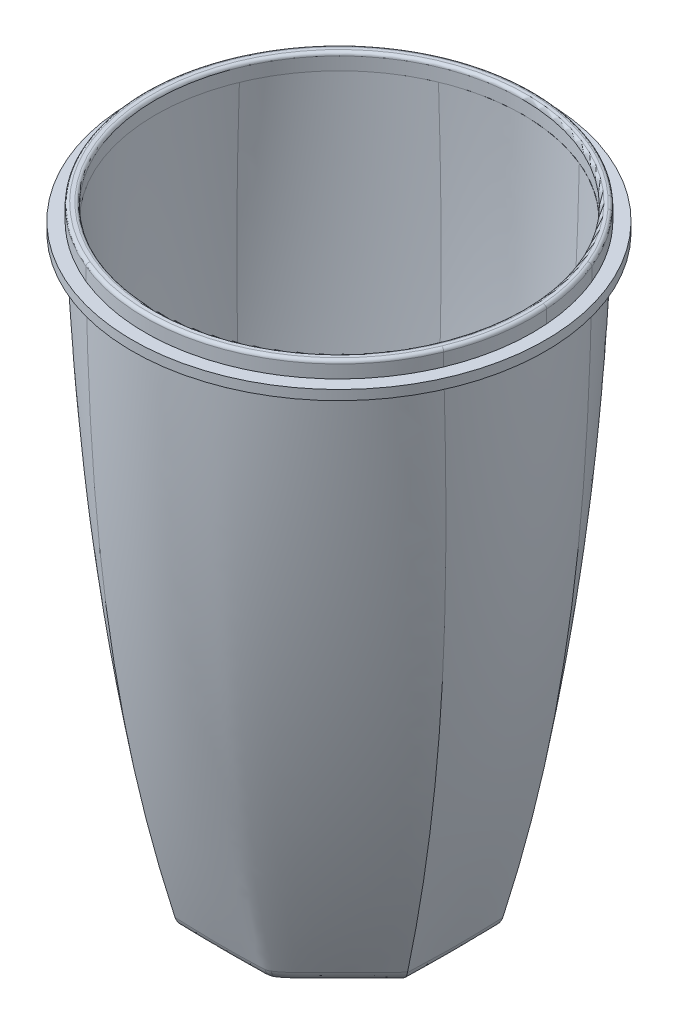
SolidWorks part; units mm, degrees
ref_plane "Front Plane" through (0, 0, 0) normal (0, 0, 1) x (1, 0, 0)
ref_plane "Top Plane" through (0, 0, 0) normal (0, 1, 0) x (1, 0, 0)
ref_plane "Right Plane" through (0, 0, 0) normal (1, 0, 0) x (0, 0, -1)
sketch "Sketch1" plane through (0, 0, 0) normal (0, 0, 1) x (1, 0, 0)
  line L0 (0, 0) -> (0, 180) construction
  line L1 (-60, 180) -> (60, 180) construction
  line L2 (60, 252.6876) -> (60, 107.3124) construction
  line L3 (35, 0) -> (-35, 0) construction
  spline S0 degree 3 poles (35, 0) (56.3532, 64.0298) (60, 119.427) (60, 180) knots 0 0 0 0 1 1 1 1
  spline S1 degree 3 poles (-35, 0) (-56.3532, 64.0298) (-60, 119.427) (-60, 180) knots 0 0 0 0 1 1 1 1
  dimension "D1" = 180
  dimension "D2" = 60
  dimension "D3" = 35
sketch "Sketch6" plane through (0, 0, 0) normal (0, 1, 0) x (1, 0, 0)
  line L0 (0, 0) -> (35, 0) construction
  line L1 (35, -14.4975) -> (35, 14.4975)
  line L2 (35, 14.4975) -> (14.4975, 35)
  line L3 (14.4975, 35) -> (-14.4975, 35)
  line L4 (-14.4975, 35) -> (-35, 14.4975)
  line L5 (-35, 14.4975) -> (-35, -14.4975)
  line L6 (-35, -14.4975) -> (-14.4975, -35)
  line L7 (-14.4975, -35) -> (14.4975, -35)
  line L8 (14.4975, -35) -> (35, -14.4975)
  line L9 (35, 0) -> (-35, 0) construction
  circle A0 centre (0, 0) radius 35 construction
ref_plane "Plane3" through (0, 180, 0) normal (0, 1, 0) x (1, 0, 0)
sketch "Sketch7" plane through (0, 180, 0) normal (0, 1, 0) x (1, 0, 0)
  circle A0 centre (0, 0) radius 60
sketch "Sketch8" plane through (0, 0, 0) normal (1, 0, 0) x (0, 0, -1)
  line L0 (0, 0) -> (0, 180) construction
  line L1 (-60, 180) -> (60, 180) construction
  line L2 (60, 252.6876) -> (60, 107.3124) construction
  line L3 (35, 0) -> (-35, 0) construction
  spline S0 degree 3 poles (35, 0) (56.3532, 64.0298) (60, 119.427) (60, 180) knots 0 0 0 0 1 1 1 1
  spline S1 degree 3 poles (-35, 0) (-56.3532, 64.0298) (-60, 119.427) (-60, 180) knots 0 0 0 0 1 1 1 1
  dimension "D1" = 180
  dimension "D2" = 60
  dimension "D3" = 35
loft "Loft1" add profiles "Sketch6", "Sketch7"
shell "Shell2" thickness 3
fillet "Fillet1" radius 5 6 edges at (32.8311, 3, 1.7594) (12.7425, 3, 32.6342) (-32.6342, 3, 12.7425) (-23.1273, 3, -23.1277) (1.7594, 3, -32.8311) (23.1277, 3, -23.1273)
fillet "Fillet2" radius 5 6 edges at (0, 0, -35) (-24.7487, 0, -24.7487) (35, 0, 0) (24.7487, 0, -24.7487)
sketch "Sketch9" plane through (0, 180, 0) normal (0, 1, 0) x (1, 0, 0)
  circle A0 centre (0, 0) radius 60
  circle A1 centre (0, 0) radius 64
  dimension "D1" = 4
extrude "Boss-Extrude1" add sketch "Sketch9" against normal blind 3 separate body
sketch "Sketch10" plane through (0, 180, 0) normal (0, 1, 0) x (1, 0, 0)
  circle A0 centre (0.0741, 0.0741) radius 56.9599
  arc A1 (44.2404, 40.5313) -> (40.5313, 44.2404) centre (0.0741, 0.0741) ccw
  arc A2 (44.2404, 40.5313) -> (40.5313, 44.2404) centre (0.0741, 0.0741) ccw
  spline S8 degree 2 poles (-3966.3836, -2910.012) (258.9396, -294.8696) (50.6051, 32.2357) (-157.23, 358.5567) (-4344.8489, -2307.8217) knots -36.438238 -36.438238 -36.438238 0.5 0.5 37.391848 37.391848 37.391848 only from (55.4328, 22.961) to (44.2404, 40.5313)
  spline S9 degree 2 poles (-2314.9005, -4341.1384) (358.666, -157.311) (32.2357, 50.6051) (-294.7532, 258.877) (-2916.4678, -3961.6011) knots -36.399566 -36.399566 -36.399566 0.5 0.5 37.430902 37.430902 37.430902 only from (40.5313, 44.2404) to (22.961, 55.4328)
  spline S10 degree 3 poles (-4901.4206, -188.4562) (137.6866, -648.5368) (170.941, 19.0604) (11.7242, 58.9417) (5.8905, 59.8071) (1.9635, 60) (-1.9635, 60) (-5.8905, 59.8071) (-11.7242, 58.9417) (-170.942, 19.0601) (-137.6862, -648.5451) (4901.516, -188.4474) knots -1.132702 -1.132702 -1.132702 -1.132702 0.140625 0.15625 0.171875 0.1875 0.1875 0.203125 0.21875 0.234375 1.50771 1.50771 1.50771 1.50771 only from (22.961, 55.4328) to (-22.961, 55.4328)
  spline S11 degree 3 poles (-3157.8086, -3750.8838) (595.4923, -311.7776) (88.4365, 150.3244) (-42.6999, 42.6999) (-150.3236, -88.4355) (311.7707, -595.4848) (3750.8054, 3157.7231) knots -0.999756 -0.999756 -0.999756 -0.999756 0.28125 0.3125 0.34375 1.624746 1.624746 1.624746 1.624746 only from (-22.961, 55.4328) to (-55.4328, 22.961)
  spline S12 degree 3 poles (188.4599, -4901.3799) (648.5332, 137.6868) (-19.0605, 170.9406) (-58.9417, 11.7242) (-59.8071, 5.8905) (-60, 1.9635) (-60, 0) (-60, -1.9635) (-59.8071, -5.8905) (-58.9417, -11.7242) (-57.5087, -17.4451) (-56.1842, -21.147) (-53.93, -26.5891) (-50.21, -33.5492) (-42.6999, -42.6999) (88.4371, -150.325) (595.4974, 311.7822) (-3157.8665, 3750.9369) knots -0.882698 -0.882698 -0.882698 -0.882698 0.390625 0.40625 0.421875 0.4375 0.4375 0.4375 0.453125 0.46875 0.484375 0.5 0.5 0.53125 0.5625 0.59375 1.874762 1.874762 1.874762 1.874762 only from (-55.4328, 22.961) to (-22.961, -55.4328)
  spline S13 degree 3 poles (4901.3799, 188.4599) (-137.6868, 648.5332) (-170.9406, -19.0605) (-11.7242, -58.9417) (-5.8905, -59.8071) (-1.9635, -60) (0, -60) (1.9635, -60) (5.8905, -59.8071) (11.7242, -58.9417) (17.4451, -57.5087) (21.147, -56.1842) (26.5891, -53.93) (33.5492, -50.21) (42.6999, -42.6999) (150.325, 88.4371) (-311.7822, 595.4974) (-3750.9369, -3157.8665) knots -0.632698 -0.632698 -0.632698 -0.632698 0.640625 0.65625 0.671875 0.6875 0.6875 0.6875 0.703125 0.71875 0.734375 0.75 0.75 0.78125 0.8125 0.84375 2.124762 2.124762 2.124762 2.124762 only from (-22.961, -55.4328) to (55.4328, -22.961)
  spline S14 degree 3 poles (-188.4481, 4901.5089) (-648.5445, -137.6862) (19.0602, -170.9419) (58.9417, -11.7242) (59.8071, -5.8905) (60, -1.9635) (60, 0) (60, 159.961) (-580.1506, 319.9151) (-1616.7885, -4631.7589) knots -0.382709 -0.382709 -0.382709 -0.382709 0.890625 0.90625 0.921875 0.9375 0.9375 0.9375 2.210429 2.210429 2.210429 2.210429 only from (55.4328, -22.961) to (59.8297, 4.5168)
  spline S15 degree 2 poles (-4684.7856, -1500.5654) (148.1554, -362.7462) (58.3644, 13.9137) (-31.4035, 390.4769) (-4859.2149, -766.4055) knots -40.082476 -40.082476 -40.082476 0.5 0.5 41.077301 41.077301 41.077301 only from (59.8297, 4.5168) to (55.4328, 22.961)
  spline S16 degree 2 poles (55.4328, 22.961) (53.4251, 27.808) (50.6051, 32.2357) (47.7882, 36.6584) (44.2404, 40.5313) knots 0 0 0 0.5 0.5 1 1 1
  spline S17 degree 2 poles (40.5313, 44.2404) (36.6589, 47.7877) (32.2357, 50.6051) (27.8087, 53.4248) (22.961, 55.4328) knots 0 0 0 0.5 0.5 1 1 1
  spline S18 degree 3 poles (22.961, 55.4328) (21.147, 56.1842) (17.4451, 57.5087) (11.7242, 58.9417) (5.8905, 59.8071) (1.9635, 60) (-1.9635, 60) (-5.8905, 59.8071) (-11.7242, 58.9417) (-17.4451, 57.5087) (-21.147, 56.1842) (-22.961, 55.4328) knots 0.125 0.125 0.125 0.125 0.140625 0.15625 0.171875 0.1875 0.1875 0.203125 0.21875 0.234375 0.25 0.25 0.25 0.25
  spline S19 degree 3 poles (-22.961, 55.4328) (-26.5891, 53.93) (-33.5492, 50.21) (-42.6999, 42.6999) (-50.21, 33.5492) (-53.93, 26.5891) (-55.4328, 22.961) knots 0.25 0.25 0.25 0.25 0.28125 0.3125 0.34375 0.375 0.375 0.375 0.375
  spline S20 degree 3 poles (-55.4328, 22.961) (-56.1842, 21.147) (-57.5087, 17.4451) (-58.9417, 11.7242) (-59.8071, 5.8905) (-60, 1.9635) (-60, 0) (-60, -1.9635) (-59.8071, -5.8905) (-58.9417, -11.7242) (-57.5087, -17.4451) (-56.1842, -21.147) (-53.93, -26.5891) (-50.21, -33.5492) (-42.6999, -42.6999) (-33.5492, -50.21) (-26.5891, -53.93) (-22.961, -55.4328) knots 0.375 0.375 0.375 0.375 0.390625 0.40625 0.421875 0.4375 0.4375 0.4375 0.453125 0.46875 0.484375 0.5 0.5 0.53125 0.5625 0.59375 0.625 0.625 0.625 0.625
  spline S21 degree 3 poles (-22.961, -55.4328) (-21.147, -56.1842) (-17.4451, -57.5087) (-11.7242, -58.9417) (-5.8905, -59.8071) (-1.9635, -60) (0, -60) (1.9635, -60) (5.8905, -59.8071) (11.7242, -58.9417) (17.4451, -57.5087) (21.147, -56.1842) (26.5891, -53.93) (33.5492, -50.21) (42.6999, -42.6999) (50.21, -33.5492) (53.93, -26.5891) (55.4328, -22.961) knots 0.625 0.625 0.625 0.625 0.640625 0.65625 0.671875 0.6875 0.6875 0.6875 0.703125 0.71875 0.734375 0.75 0.75 0.78125 0.8125 0.84375 0.875 0.875 0.875 0.875
  spline S22 degree 3 poles (55.4328, -22.961) (56.1842, -21.147) (57.5087, -17.4451) (58.9417, -11.7242) (59.8071, -5.8905) (60, -1.9635) (60, 0) (60, 1.507) (59.9432, 3.0141) (59.8297, 4.5168) knots 0.875 0.875 0.875 0.875 0.890625 0.90625 0.921875 0.9375 0.9375 0.9375 0.949493 0.949493 0.949493 0.949493
  spline S23 degree 2 poles (59.8297, 4.5168) (59.4707, 9.273) (58.3644, 13.9137) (57.2583, 18.5538) (55.4328, 22.961) knots 0 0 0 0.5 0.5 1 1 1
  dimension "D1" = 0
extrude "Boss-Extrude3" add sketch "Sketch10" along normal blind 5 separate body
fillet "Fillet3" radius 1 10 edges at (-56.8859, 185, -0.0741)
